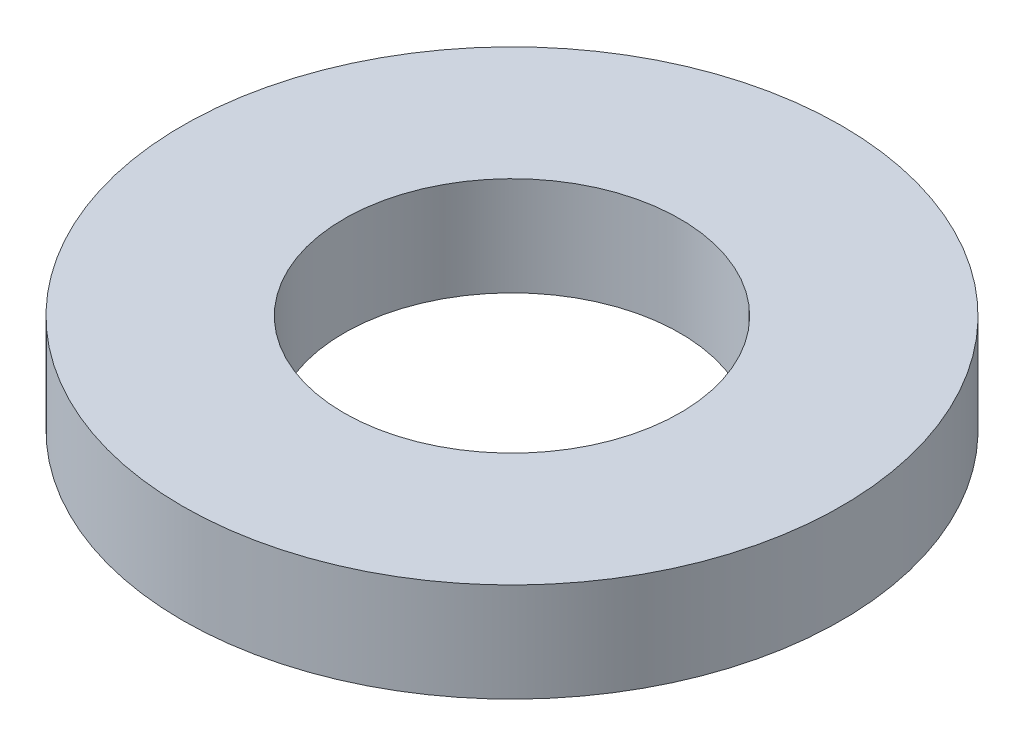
SolidWorks part; units mm, degrees
ref_plane "Alzado" through (0, 0, 0) normal (0, 0, 1) x (1, 0, 0)
ref_plane "Planta" through (0, 0, 0) normal (0, 1, 0) x (1, 0, 0)
ref_plane "Vista lateral" through (0, 0, 0) normal (1, 0, 0) x (0, 0, -1)
sketch "Sketch1" plane through (0, 0, 0) normal (0, 1, 0) x (1, 0, 0)
  circle A0 centre (0, 0) radius 5.1
  circle A1 centre (0, 0) radius 10
  dimension "D1" = 10.2
  dimension "D2" = 20
extrude "Boss-Extrude1" add sketch "Sketch1" along normal blind 3
